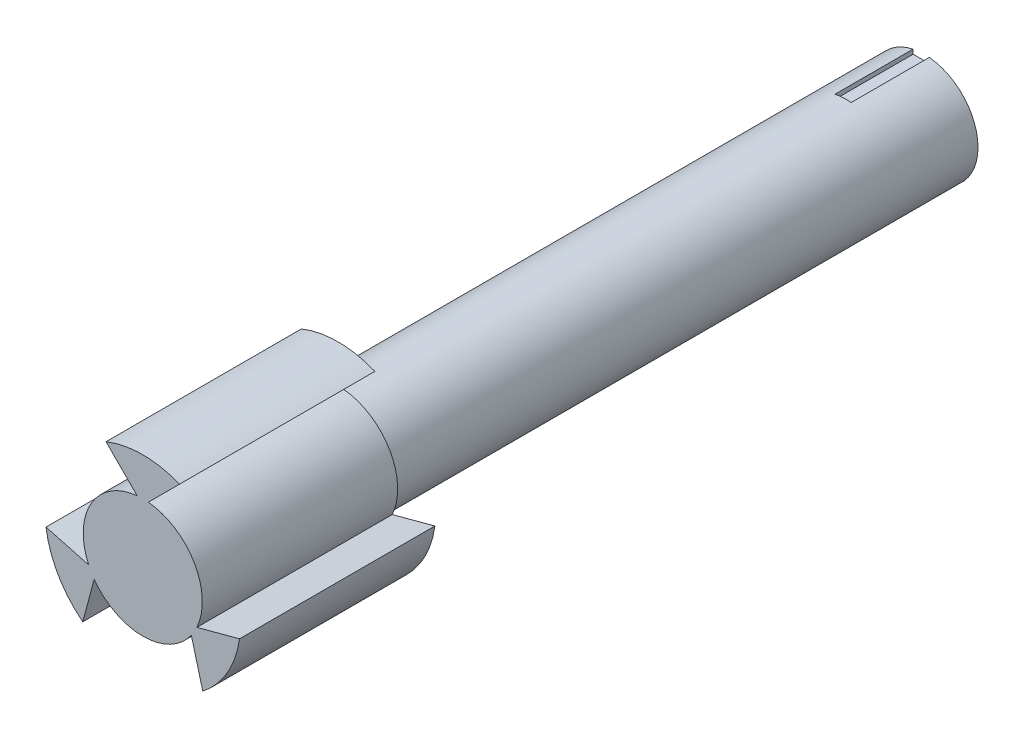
SolidWorks part; units mm, degrees
ref_plane "Front Plane" through (0, 0, 0) normal (0, 0, 1) x (1, 0, 0)
ref_plane "Top Plane" through (0, 0, 0) normal (0, 1, 0) x (1, 0, 0)
ref_plane "Right Plane" through (0, 0, 0) normal (1, 0, 0) x (0, 0, -1)
sketch "Sketch1" plane through (0, 0, 0) normal (0, 0, 1) x (1, 0, 0)
  line L3 (0, 0) -> (0, 100)
  line L4 (-5.6781, 60.6781) -> (-37.6441, 92.6441)
  line L5 (5.6781, 60.6781) -> (37.6441, 92.6441)
  line L6 (49.7097, -35.2565) -> (61.4101, -78.9228)
  line L7 (55.3879, -25.4217) -> (99.0542, -13.7213)
  line L8 (-55.3879, -25.4217) -> (-99.0542, -13.7213)
  line L9 (-49.7097, -35.2565) -> (-61.4101, -78.9228)
  arc A3 (37.6441, 92.6441) -> (-37.6441, 92.6441) centre (0, 0) ccw
  arc A4 (-5.6781, 60.6781) -> (-55.3879, -25.4217) centre (0, 0) ccw
  arc A5 (61.4101, -78.9228) -> (99.0542, -13.7213) centre (0, 0) ccw
  arc A6 (-99.0542, -13.7213) -> (-61.4101, -78.9228) centre (0, 0) ccw
  arc A7 (55.3879, -25.4217) -> (5.6781, 60.6781) centre (0, 0) ccw
  arc A8 (-49.7097, -35.2565) -> (49.7097, -35.2565) centre (0, 0) ccw
  dimension "D4" = 45
  dimension "D5" = 3
  dimension "D2" = 200
  dimension "D3" = 45
extrude "Boss-Extrude1" add sketch "Sketch1" along normal blind 200
sketch "Sketch2" plane through (0, 0, 200) normal (0, 0, 1) x (1, 0, 0)
  circle A0 centre (0, 0) radius 55
  dimension "D1" = 110
extrude "Boss-Extrude2" add sketch "Sketch2" against normal blind 800
sketch "Sketch4" plane through (0, 0, -600) normal (0, 0, -1) x (-1, 0, 0)
  line L1 (-5.1785, 49.271) -> (-5.1785, 61.8901)
  line L2 (-5.1785, 61.8901) -> (11.4331, 61.8901)
  line L5 (-5.1785, 49.271) -> (11.4331, 49.271)
  line L6 (11.4331, 49.271) -> (11.4331, 61.8901)
extrude "Cut-Extrude1" cut sketch "Sketch4" against normal blind 80
